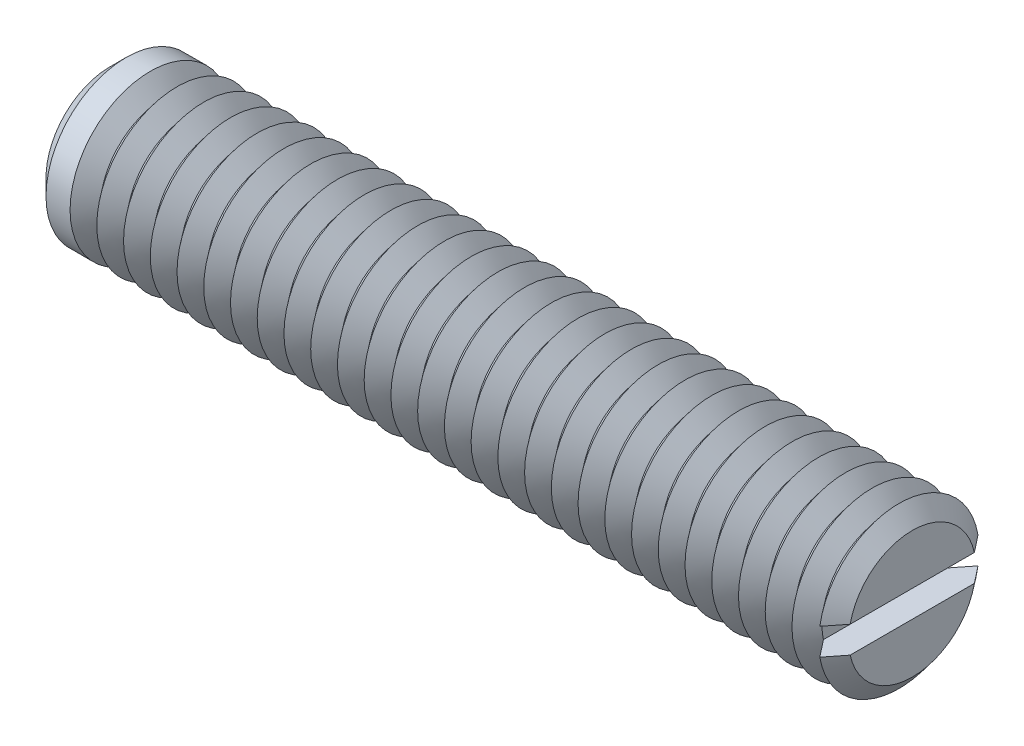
SolidWorks part; units mm, degrees
ref_plane "Front Plane" through (0, 0, 0) normal (0, 0, 1) x (1, 0, 0)
ref_plane "Top Plane" through (0, 0, 0) normal (0, 1, 0) x (1, 0, 0)
ref_plane "Right Plane" through (0, 0, 0) normal (1, 0, 0) x (0, 0, -1)
sketch "Sketch1" plane through (0, 0, 0) normal (1, 0, 0) x (0, 0, -1)
  circle A0 centre (0, 0) radius 3
  dimension "D1" = 6
extrude "Extrude1" add sketch "Sketch1" along normal mid plane 30
sketch "Sketch2" plane through (0, 0, 0) normal (0, 0, 1) x (1, 0, 0)
  line L0 (15, 0.5) -> (14, 0.5)
  line L1 (15, -3) -> (15, 3) construction
  line L2 (14, 0.5) -> (14, -0.5)
  line L3 (0, 0) -> (50000, 0) construction
  line L4 (15, -0.5) -> (14, -0.5)
  line L5 (15, -0.5) -> (15, 0.5)
  point P9 (14, 0)
  dimension "D1" = 1
extrude "Extrude2" cut sketch "Sketch2" against normal mid plane 9
chamfer "Chamfer1" distance 0.6 angle 45 1 edges at (-15, 0, -3)
sketch "Sketch3" plane through (0, 0, 0) normal (0, 0, 1) x (1, 0, 0)
  line L0 (0, 0) -> (30.9602, 0) construction
  line L1 (14.5, -3) -> (15.5, -3)
  line L2 (-14.4, -3) -> (15, -3) construction
  line L3 (15.5, -3) -> (15, -2.3755)
  line L4 (15, -3) -> (15, -0.5) construction
  line L5 (15, -2.3755) -> (14.5, -3)
  dimension "D1" = 1
  dimension "D2" = 0.8
revolve "Cut-Revolve1" cut sketch "Sketch3" angle 360 about L0
pattern_linear "LPattern1" count 29 spacing 1 along (-1, 0, 0) of "Cut-Revolve1"
equation "\"D2@Sketch3\" = \"D1@Sketch3\"*0.8"
